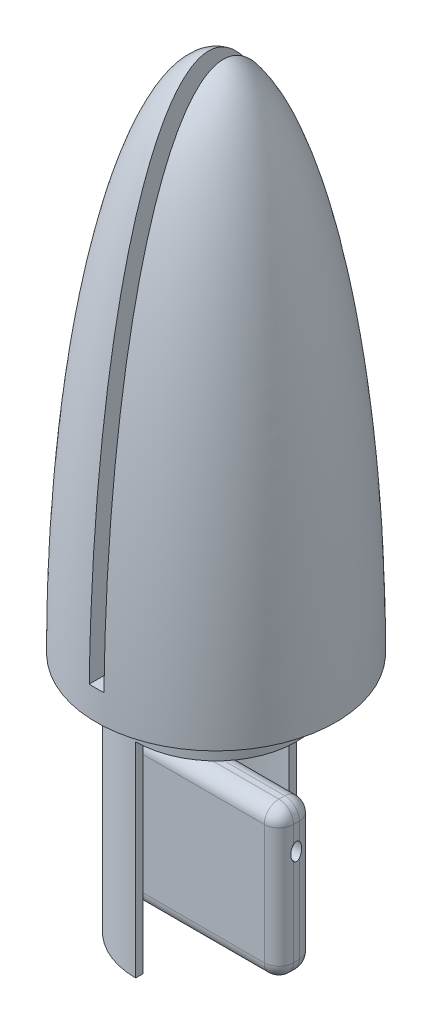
SolidWorks part; units mm, degrees
ref_plane "Plan1" through (0, 0, 0) normal (0, 0, 1) x (1, 0, 0)
ref_plane "Plan2" through (0, 0, 0) normal (0, 1, 0) x (1, 0, 0)
ref_plane "Plan3" through (0, 0, 0) normal (1, 0, 0) x (0, 0, -1)
sketch "Esquisse1" plane through (0, 0, 0) normal (0, 0, 1) x (1, 0, 0)
  line L0 (0, 0) -> (5.5, 0)
  line L1 (0, 0) -> (0, 38)
  line L2 (5.5, 0) -> (5.5, 2.5)
  line L3 (5.5, 2.5) -> (8.2, 2.5)
  ellipse E0 centre (0, 2.5) end of major axis (0, 38) minor radius 8.2 (0, 38) -> (8.2, 2.5) cw
  dimension "D1" = 5.5
  dimension "D2" = 38
  dimension "D3" = 2.5
  dimension "D4" = 8.2
revolve "Révolution1" add sketch "Esquisse1" angle 360 about L1
sketch "Esquisse2" plane through (0, 0, 0) normal (0, 0, 1) x (1, 0, 0)
  line L0 (0.5, 4.5) -> (-0.5, 4.5)
  line L1 (-0.5, 4.5) -> (-0.5, 38.8956)
  line L2 (-0.5, 38.8956) -> (0.5, 38.8956)
  line L3 (0.5, 38.8956) -> (0.5, 4.5)
  line L4 (-8.2, 2.5) -> (8.2, 2.5) construction
  dimension "D1" = 1
  dimension "D2" = 0.5
  dimension "D3" = 2
extrude "Enlèv. mat.-Extru.1" cut sketch "Esquisse2" against normal mid plane 20
sketch "Esquisse3" plane through (0, 0, 0) normal (0, -1, 0) x (1, 0, 0)
  arc A0 (0, -5) -> (0, 5) centre (0, 0) cw
  dimension "D1" = 5
extrude "Extru.-Mince2" add sketch "Esquisse3" along normal blind 14 thin
ref_plane "Plan4" through (-5, 0, 0) normal (1, 0, 0) x (0, 0, -1)
sketch "Esquisse6" plane through (-5, 0, 0) normal (1, 0, 0) x (0, 0, -1)
  line L0 (-0.5, 0) -> (0.5, 0)
  line L1 (0.5, 0) -> (0.5, -3.8)
  line L2 (0.5, -3.8) -> (-0.5, -3.8)
  line L3 (-0.5, -3.8) -> (-0.5, 0)
  line L4 (-5.5, 0) -> (5.5, 0) construction
  dimension "D1" = 1
  dimension "D2" = 0.5
  dimension "D3" = 3.8
extrude "Extrusion1" add sketch "Esquisse6" along normal blind 2
sketch "Esquisse7" plane through (-5, 0, 0) normal (1, 0, 0) x (0, 0, -1)
  line L0 (-0.2, -3.8) -> (0.2, -3.8)
  line L1 (1.2, -4.8) -> (1.2, -13)
  line L2 (0.2, -14) -> (-0.2, -14)
  line L3 (-1.2, -13) -> (-1.2, -4.8)
  line L4 (-0.5, -3.8) -> (0.5, -3.8) construction
  line L5 (-5, -14) -> (5, -14) construction
  arc A0 (-0.2, -3.8) -> (-1.2, -4.8) centre (-0.2, -4.8) ccw
  arc A1 (0.2, -3.8) -> (1.2, -4.8) centre (0.2, -4.8) cw
  arc A2 (0.2, -14) -> (1.2, -13) centre (0.2, -13) ccw
  arc A3 (-1.2, -13) -> (-0.2, -14) centre (-0.2, -13) ccw
  point P13 (1.2, -3.8)
  point P16 (1.2, -14)
  point P19 (-1.2, -14)
  dimension "D3" = 1
  dimension "D1" = 2.4
  dimension "D2" = 1.2
extrude "Extrusion2" add sketch "Esquisse7" along normal blind 10.5
fillet "Congé1" radius 1 8 edges at (5.5, -4.0929, 0.9071) (5.5, -8.9, 1.2) (5.5, -13.7071, 0.9071) (5.5, -14, 0) (5.5, -13.7071, -0.9071) (5.5, -8.9, -1.2) (5.5, -4.0929, -0.9071) (5.5, -3.8, 0)
sketch "Esquisse8" plane through (5.5, 0, 0) normal (1, 0, 0) x (0, 0, -1)
  ellipse E0 centre (0, -6.5) end of major axis (0, -5.9) minor radius 0.3683
  dimension "D1" = 1.2
  dimension "D2" = 0.7365
  dimension "D3" = 6.5
extrude "Enlèv. mat.-Extru.2" cut sketch "Esquisse8" against normal through all
sketch "Esquisse9" plane through (-5, 0, 0) normal (1, 0, 0) x (0, 0, -1)
  line L0 (-1.9005, 2) -> (-1.9005, 2.5)
  line L1 (-1.9005, 2.5) -> (1.9005, 2.5)
  line L2 (1.9005, 2.5) -> (1.9005, 2)
  line L3 (-8.2, 2.5) -> (8.2, 2.5) construction
  arc A0 (1.9005, 2) -> (-1.9005, 2) centre (0, 2) cw
  dimension "D1" = 2
extrude "Extrusion3" add sketch "Esquisse9" against normal blind 1.5
